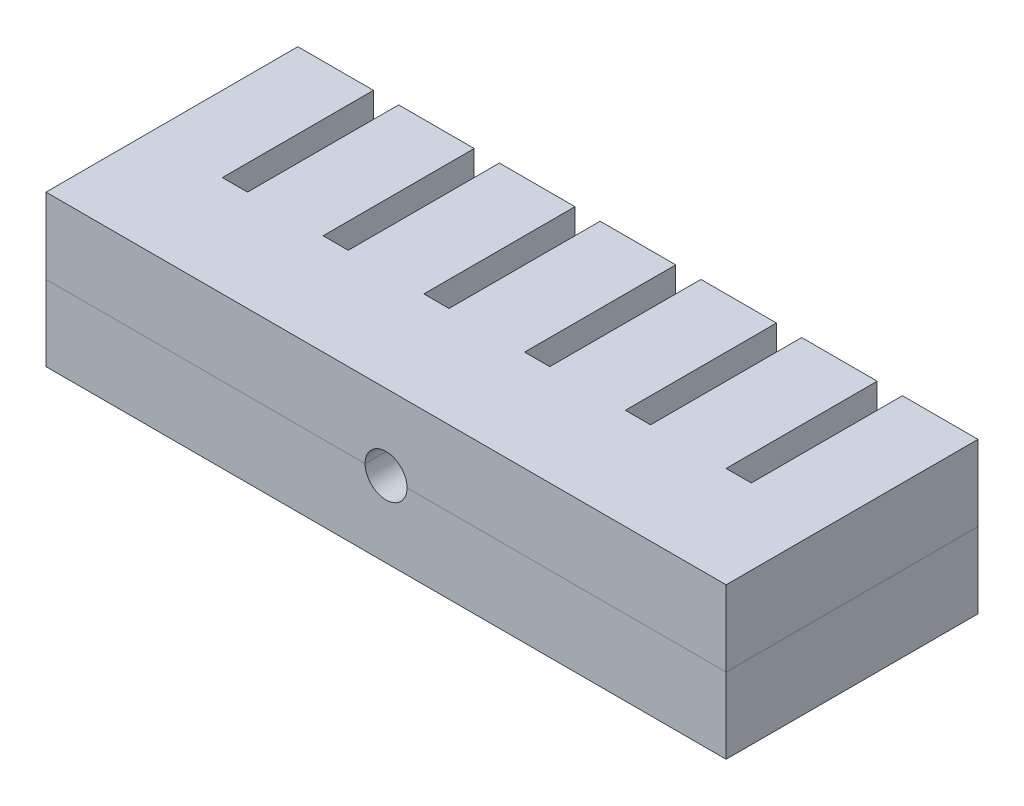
SolidWorks part; units mm, degrees
ref_plane "Front" through (0, 0, 0) normal (0, 0, 1) x (1, 0, 0)
ref_plane "Top" through (0, 0, 0) normal (0, 1, 0) x (1, 0, 0)
ref_plane "Right" through (0, 0, 0) normal (1, 0, 0) x (0, 0, -1)
sketch "Sketch1" plane through (0, 0, 0) normal (0, 1, 0) x (1, 0, 0)
  line L0 (0, 5) -> (81, 5) construction
  line L1 (0, 0) -> (81, 0) construction
  line L2 (0, 0) -> (0, 30) construction
  line L3 (0, 30) -> (81, 30) construction
  line L4 (81, 0) -> (81, 30) construction
  line L5 (0, 15) -> (81, 15) construction
  line L6 (0, 0) -> (81, 0)
  line L7 (0, 0) -> (0, 30)
  line L8 (0, 30) -> (81, 30)
  line L9 (81, 30) -> (81, 0)
  dimension "D1" = 81
  dimension "D2" = 30
  dimension "D3" = 5
extrude "Boss-Extrude1" add sketch "Sketch1" along normal mid plane 18
sketch "Sketch2" plane through (0, 0, 0) normal (0, 1, 0) x (1, 0, 0)
  line L0 (81, 30) -> (0, 30) construction
  line L1 (9, 30) -> (12, 30)
  line L2 (9, 30) -> (9, 12)
  line L3 (9, 12) -> (12, 12)
  line L4 (12, 30) -> (12, 12)
  line L5 (0, 30) -> (0, 0) construction
  point P32 (12, 12)
  point P35 (9, 12)
  dimension "D1" = 3
  dimension "D2" = 9
  dimension "D3" = 18
extrude "side relief cut" cut sketch "Sketch2" against normal through all both and the other way through all
sketch "Sketch4" plane through (0, 0, 0) normal (0, 1, 0) x (1, 0, 0)
  line L1 (2, 6) -> (7, 6)
  line L2 (2, 6) -> (2, 24)
  line L3 (2, 24) -> (7, 24)
  line L4 (7, 6) -> (7, 24)
  line L5 (0, 0) -> (81, 0) construction
  line L7 (81, 30) -> (12, 30) construction
  line L25 (0, 30) -> (0, 0) construction
  line L26 (9, 30) -> (9, 12) construction
  dimension "D1" = 2
  dimension "D2" = 2
  dimension "D3" = 6
  dimension "D5" = 6
extrude "chamber" cut sketch "Sketch4" against normal mid plane 12
pattern_linear "side relief pattern" count 6 spacing 12 along (1, 0, 0) of "side relief cut"
pattern_linear "chamber pattern" count 7 spacing 12 along (1, 0, 0) of "chamber"
sketch "Sketch3" plane through (0, 0, 0) normal (0, 1, 0) x (1, 0, 0)
  line L0 (0, 30) -> (0, 0) construction
  line L1 (2, 9) -> (79, 9)
  line L2 (2, 9) -> (2, 6)
  line L3 (2, 6) -> (79, 6)
  line L4 (79, 9) -> (79, 6)
  line L6 (81, 0) -> (81, 30) construction
  line L8 (9, 12) -> (12, 12) construction
  line L9 (2, 6) -> (7, 6) construction
  dimension "D1" = 2
  dimension "D3" = 2
  dimension "D4" = 3
extrude "manifold" cut sketch "Sketch3" against normal mid plane 6
sketch "Sketch5" plane through (0, 0, 0) normal (0, 0, -1) x (-1, 0, 0)
  line L3 (0, 9) -> (-81, -9) construction
  circle A0 centre (-40.5, 0) radius 2.5
  dimension "D1" = 5
extrude "input port" cut sketch "Sketch5" along normal blind 9
split "Split1" trim tools "Top" bodies to split 105 resulting bodies 108 109
